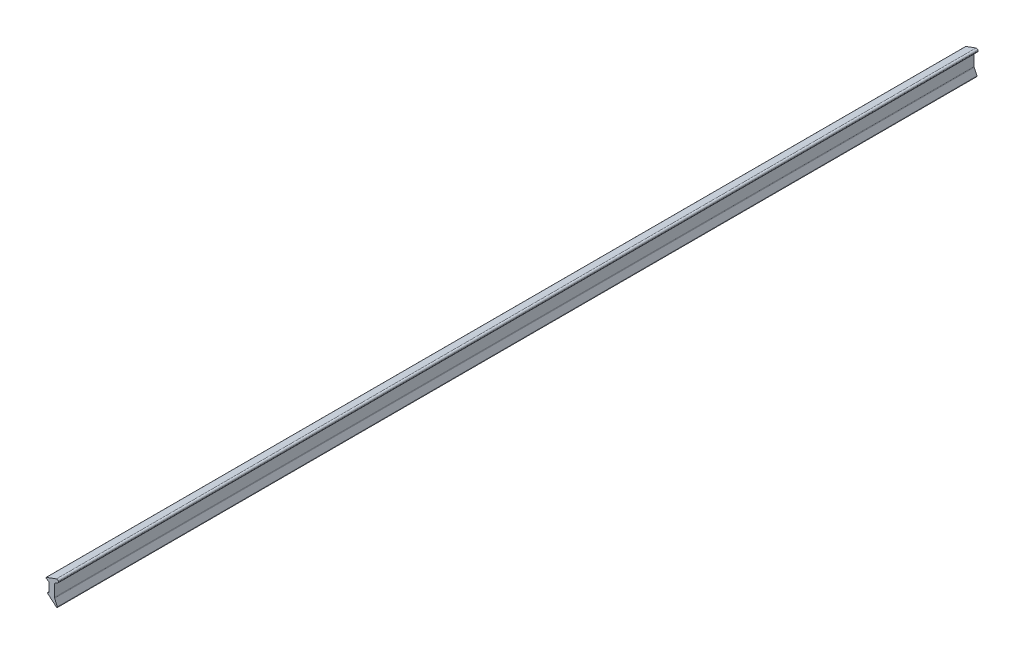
SolidWorks part; units mm, degrees
ref_plane "前视基准面" through (0, 0, 0) normal (0, 0, 1) x (1, 0, 0)
ref_plane "上视基准面" through (0, 0, 0) normal (0, 1, 0) x (1, 0, 0)
ref_plane "右视基准面" through (0, 0, 0) normal (1, 0, 0) x (0, 0, -1)
sketch "草图1" plane through (0, 0, 0) normal (0, 0, 1) x (1, 0, 0)
  line L0 (0, 0) -> (0, 3)
  line L1 (0, 3) -> (-1.3098, 3.731)
  line L2 (0, 0) -> (-0.7567, -0.2595)
  line L3 (-1.3098, 3.731) -> (2.9188, 5.2701)
  line L4 (-0.7567, -0.2595) -> (3.0634, -3.4855)
  line L5 (2.9188, 5.2701) -> (3.0664, 4.2811)
  line L6 (3.0664, 4.2811) -> (1.7358, 3.5092)
  line L7 (1.7358, 3.5092) -> (1.7358, -0.5991)
  line L8 (1.7358, -0.5991) -> (3.0634, -3.4855)
  dimension "D1" = 1.5
  dimension "D2" = 0.8
  dimension "D3" = 5
extrude "凸台-拉伸1" add sketch "草图1" along normal mid plane 300
fillet "圆角1" radius 0.5 3 edges at (3.0664, 4.2811, 0) (2.9188, 5.2701, 0) (1.7358, -0.5991, 0)
fillet "圆角2" radius 0.2 3 edges at (3.0634, -3.4855, 0) (-0.7567, -0.2595, 0) (-1.3098, 3.731, 0)
